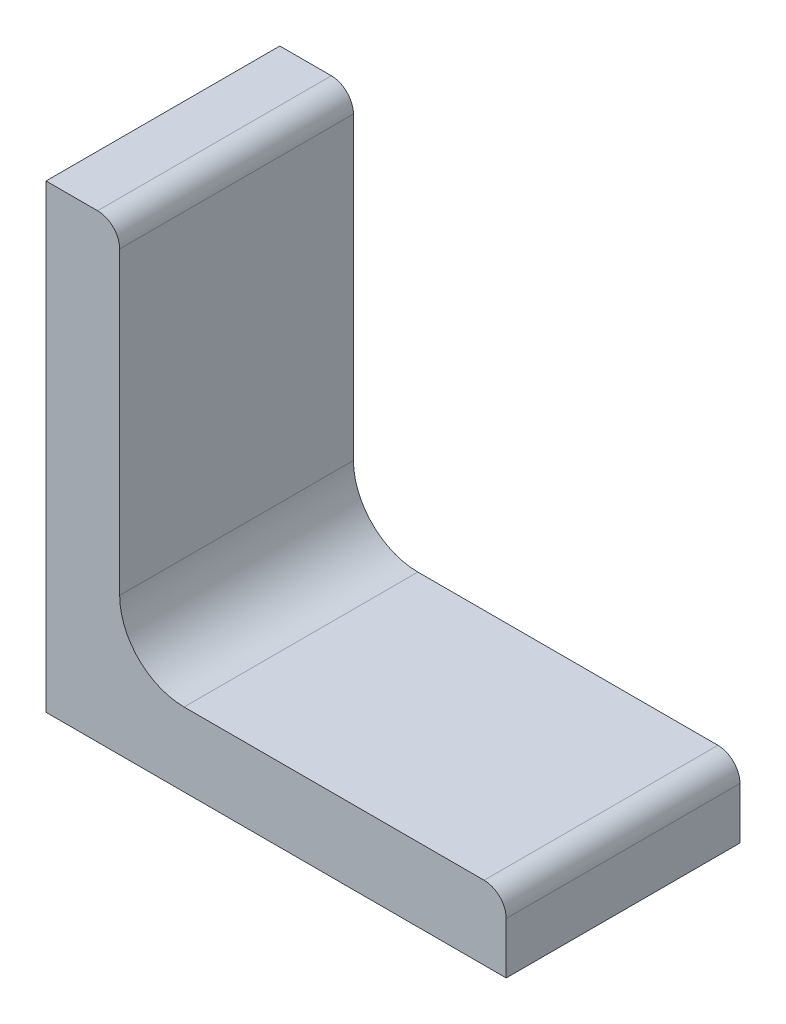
SolidWorks part; units mm, degrees
ref_plane "Front Plane" through (0, 0, 0) normal (0, 0, 1) x (1, 0, 0)
ref_plane "Top Plane" through (0, 0, 0) normal (0, 1, 0) x (1, 0, 0)
ref_plane "Right Plane" through (0, 0, 0) normal (1, 0, 0) x (0, 0, -1)
other "Configuration Table"
sketch "Sketch1" plane through (0, 0, 0) normal (0, 0, 1) x (1, 0, 0)
  line L1 (0, 0) -> (50, 0)
  line L2 (0, 0) -> (0, 50)
  line L3 (0, 50) -> (5.6, 50)
  line L4 (50, 0) -> (50, 5.6)
  line L6 (8, 47.6) -> (8, 15)
  line L7 (15, 8) -> (47.6, 8)
  arc A0 (8, 15) -> (15, 8) centre (15, 15) ccw
  arc A1 (5.6, 50) -> (8, 47.6) centre (5.6, 47.6) cw
  arc A2 (50, 5.6) -> (47.6, 8) centre (47.6, 5.6) ccw
  dimension "Radius_root" = 7
  dimension "Radius_toe" = 2.4
  dimension "Width" = 50
  dimension "Thickness" = 8
extrude "BaseSection" add sketch "Sketch1" along normal mid plane 25.4
